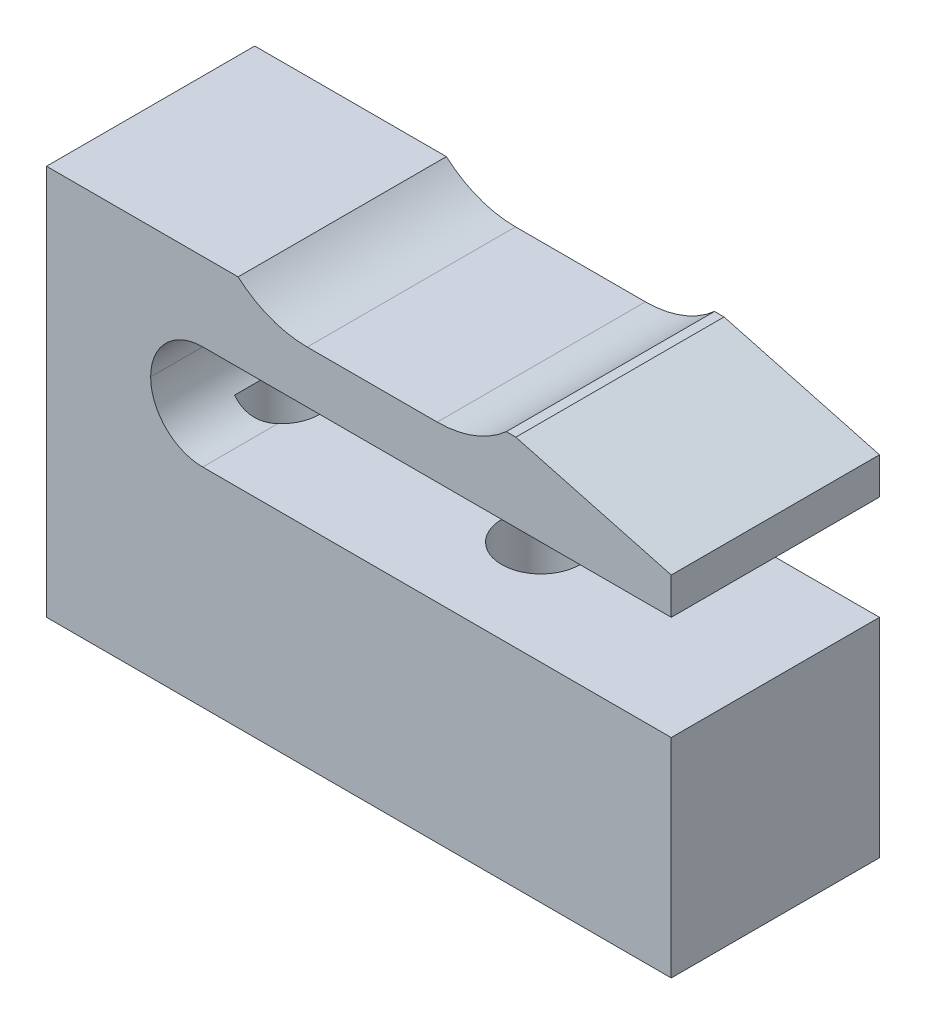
SolidWorks part; units mm, degrees
ref_plane "Front Plane" through (0, 0, 0) normal (0, 0, 1) x (1, 0, 0)
ref_plane "Top Plane" through (0, 0, 0) normal (0, 1, 0) x (1, 0, 0)
ref_plane "Right Plane" through (0, 0, 0) normal (1, 0, 0) x (0, 0, -1)
sketch "Sketch1" plane through (0, 0, 0) normal (0, 0, 1) x (1, 0, 0)
  line L0 (0, 0) -> (38.1, 0)
  line L1 (38.1, 0) -> (38.1, 12.7)
  line L2 (38.1, 12.7) -> (6.35, 12.7)
  line L3 (6.35, 12.7) -> (6.35, 19.05)
  line L4 (6.35, 19.05) -> (38.1, 19.05)
  line L5 (38.1, 19.05) -> (38.1, 23.8252)
  line L6 (38.1, 23.8252) -> (0, 23.8252)
  line L7 (0, 23.8252) -> (0, 0)
  line L8 (7.9248, 0) -> (7.9248, 10.7615) construction
  line L9 (23.7998, 0) -> (23.7998, 10.7615) construction
  line L10 (15.9004, 28.575) -> (23.8252, 28.575) construction
  line L11 (15.9004, 34.925) -> (23.8252, 34.925)
  line L12 (15.9004, 22.225) -> (23.8252, 22.225)
  arc A1 (15.9004, 34.925) -> (15.9004, 22.225) centre (15.9004, 28.575) ccw
  arc A2 (23.8252, 22.225) -> (23.8252, 34.925) centre (23.8252, 28.575) ccw
  point P16 (19.8628, 28.575)
  dimension "D8" = 6.35
  dimension "D1" = 23.8252
  dimension "D2" = 6.35
  dimension "D3" = 12.7
  dimension "D4" = 38.1
  dimension "D5" = 6.35
  dimension "D6" = 7.9248
  dimension "D7" = 15.875
  dimension "D9" = 28.575
  dimension "D10" = 7.9248
  dimension "D11" = 23.8252
  dimension "D12" = 14.3002
sketch "Sketch2" plane through (0, 0, 0) normal (0, 0, 1) x (1, 0, 0)
  line L0 (0, 0) -> (38.1, 0) construction
  line L1 (38.1, 0) -> (38.1, 12.7) construction
  line L2 (38.1, 12.7) -> (6.35, 12.7) construction
  line L3 (6.35, 12.7) -> (6.35, 19.05) construction
  line L4 (6.35, 19.05) -> (38.1, 19.05) construction
  line L5 (38.1, 19.05) -> (38.1, 23.8252) construction
  line L6 (38.1, 23.8252) -> (0, 23.8252) construction
  line L7 (0, 23.8252) -> (0, 0) construction
  line L8 (0, 0) -> (38.1, 0)
  line L9 (38.1, 0) -> (38.1, 12.7)
  line L10 (38.1, 12.7) -> (6.35, 12.7)
  line L11 (6.35, 12.7) -> (6.35, 19.05)
  line L12 (6.35, 19.05) -> (38.1, 19.05)
  line L13 (38.1, 19.05) -> (38.1, 23.8252)
  line L14 (38.1, 23.8252) -> (0, 23.8252)
  line L15 (0, 23.8252) -> (0, 0)
extrude "Boss-Extrude1" add sketch "Sketch2" along normal mid plane 12.7
sketch "Sketch4" plane through (0, 0, 0) normal (0, 0, 1) x (1, 0, 0)
  line L0 (15.9004, 22.225) -> (23.8252, 22.225) construction
  line L1 (15.9004, 34.925) -> (23.8252, 34.925) construction
  line L2 (15.9004, 22.225) -> (23.8252, 22.225)
  line L3 (15.9004, 34.925) -> (23.8252, 34.925)
  arc A0 (15.9004, 34.925) -> (15.9004, 22.225) centre (15.9004, 28.575) ccw construction
  arc A1 (23.8252, 22.225) -> (23.8252, 34.925) centre (23.8252, 28.575) ccw construction
  arc A2 (15.9004, 34.925) -> (15.9004, 22.225) centre (15.9004, 28.575) ccw
  arc A3 (23.8252, 22.225) -> (23.8252, 34.925) centre (23.8252, 28.575) ccw
extrude "Cut-Extrude2" cut sketch "Sketch4" against normal mid plane 25.4
fillet "Fillet1" radius 3.175 2 edges at (6.35, 12.7, 0) (6.35, 19.05, 0)
chamfer "Chamfer1" distance 2.54 angle 75 1 edges at (38.1, 23.8252, 0)
sketch "Sketch3" plane through (0, 0, 0) normal (0, 1, 0) x (1, 0, 0)
  circle A0 centre (7.9248, 0) radius 2.3876
  circle A1 centre (23.7998, 0) radius 2.3876
  dimension "D1" = 4.7752
extrude "Cut-Extrude1" cut sketch "Sketch3" along normal blind 13.462
